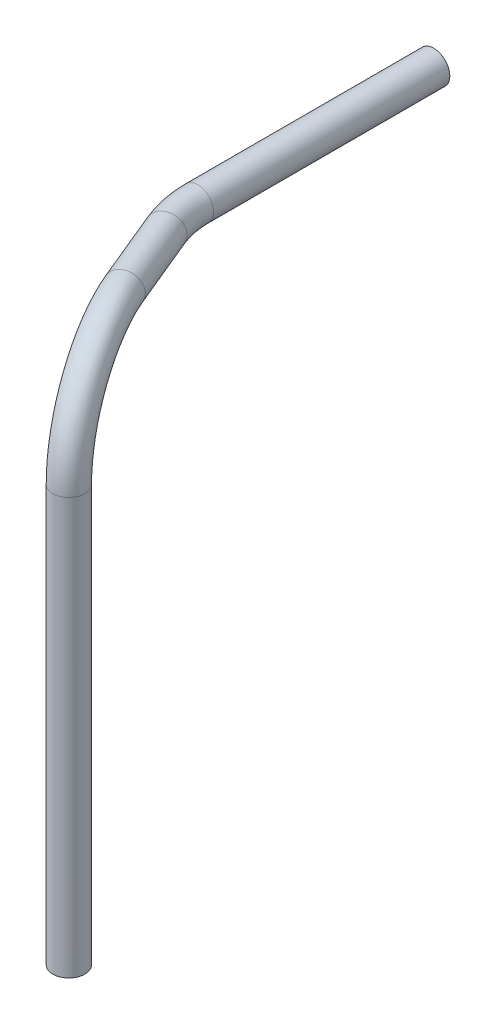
SolidWorks part; units mm, degrees
ref_plane "Front" through (0, 0, 0) normal (0, 0, 1) x (1, 0, 0)
ref_plane "Top" through (0, 0, 0) normal (0, 1, 0) x (1, 0, 0)
ref_plane "Right" through (0, 0, 0) normal (1, 0, 0) x (0, 0, -1)
sketch "Sketch1" plane through (0, 0, 0) normal (0, 0, 1) x (1, 0, 0)
  circle A0 centre (0, 0) radius 4.8616
  circle A1 centre (0, 0) radius 7.9375
  dimension "D1" = 9.7231
  dimension "D2" = 15.875
sketch3d "3DSketch1"
  line L0 (3.8669, 0, 136.3356) -> (18.5103, 0, 171.6877)
  line L1 (37.9506, -50.8, 218.6208) -> (37.9506, -256.8517, 218.6208)
  line L2 (0, 0, 116.8953) -> (0, 0, 0)
  arc A0 (18.5103, 0, 171.6877) -> (37.9506, -50.8, 218.6208) centre (18.5103, -50.8, 171.6877) ccw
  arc A1 (0, 0, 116.8953) -> (3.8669, 0, 136.3356) centre (50.8, 0, 116.8953) ccw
  point P5 (37.9506, 0, 218.6208)
  point P6 (0, 0, 203.2)
  point P7 (65.4433, -50.8, 152.2474)
  point P12 (0, 0, 127)
  point P13 (50.8, 50.8, 116.8953)
  dimension "D3" = 50.8
  dimension "D2" = 50.8
  dimension "D1" = 202.5
  dimension "D4" = 127
sweep "Sweep1" add profiles "Sketch1" path "3DSketch1"
